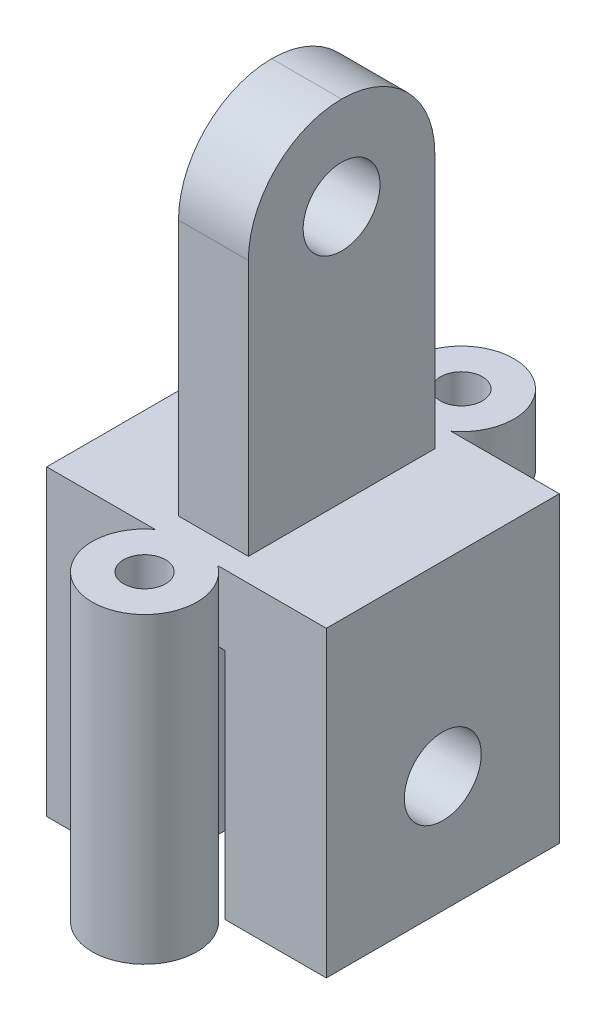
SolidWorks part; units mm, degrees
ref_plane "Front Plane" through (0, 0, 0) normal (0, 0, 1) x (1, 0, 0)
ref_plane "Top Plane" through (0, 0, 0) normal (0, 1, 0) x (1, 0, 0)
ref_plane "Right Plane" through (0, 0, 0) normal (1, 0, 0) x (0, 0, -1)
sketch "Sketch1" plane through (0, 0, 0) normal (0, 0, 1) x (1, 0, 0)
  line L0 (7.65, 0) -> (12, 0)
  line L1 (0, 0) -> (4.35, 0)
  line L2 (0, 0) -> (0, 13)
  line L3 (4.6556, 28) -> (7.6556, 28)
  line L4 (12, 0) -> (12, 13)
  line L6 (4.35, 0) -> (4.35, 10)
  line L7 (4.35, 10) -> (7.65, 10)
  line L8 (7.65, 0) -> (7.65, 10)
  line L11 (0, 13) -> (4.6556, 13)
  line L12 (4.6556, 28) -> (4.6556, 13)
  line L15 (12, 13) -> (7.6556, 13)
  line L16 (7.6556, 28) -> (7.6556, 13)
  dimension "D2" = 12
  dimension "D3" = 15
  dimension "D4" = 15
  dimension "D5" = 10
  dimension "D6" = 4.3444
  dimension "D7" = 3
  dimension "D8" = 4.35
  dimension "D9" = 3.3
extrude "Boss-Extrude1" add sketch "Sketch1" along normal blind 10
sketch "Sketch2" plane through (0, 0, 10) normal (0, 0, 1) x (1, 0, 0)
  line L0 (7.6556, 13) -> (7.6556, 28) construction
  line L1 (4.6556, 28) -> (7.6556, 28)
  line L2 (4.6556, 28) -> (4.6556, 13)
  line L3 (4.6556, 13) -> (7.6556, 13)
  line L4 (7.6556, 28) -> (7.6556, 13)
  line L5 (12, 13) -> (7.6556, 13) construction
extrude "Cut-Extrude1" cut sketch "Sketch2" against normal blind 1
sketch "Sketch3" plane through (0, 0, 0) normal (0, 0, -1) x (-1, 0, 0)
  line L1 (-7.6556, 28) -> (-4.6556, 28)
  line L2 (-7.6556, 28) -> (-7.6556, 13)
  line L3 (-7.6556, 13) -> (-4.6556, 13)
  line L4 (-4.6556, 28) -> (-4.6556, 13)
extrude "Cut-Extrude2" cut sketch "Sketch3" against normal blind 1
sketch "Sketch4" plane through (4.6556, 0, 0) normal (-1, 0, 0) x (0, 0, 1)
  line L0 (9, 28) -> (9, 13) construction
  line L1 (9, 28) -> (1, 28) construction
  circle A0 centre (5, 24) radius 1.65
  dimension "D1" = 3.3
  dimension "D2" = 4
  dimension "D3" = 4
extrude "Cut-Extrude3" cut sketch "Sketch4" against normal through all
fillet "Fillet1" radius 4 2 edges at (6.1556, 28, 1) (6.1556, 28, 9)
sketch "Sketch5" plane through (0, 0, 0) normal (-1, 0, 0) x (0, 0, 1)
  line L0 (10, 13) -> (10, 0) construction
  line L1 (10, 0) -> (0, 0) construction
  circle A0 centre (5, 5) radius 1.65
  dimension "D1" = 3.3
  dimension "D2" = 5
  dimension "D3" = 5
extrude "Cut-Extrude4" cut sketch "Sketch5" against normal through all
sketch "Sketch6" plane through (0, 10, 0) normal (0, -1, 0) x (1, 0, 0)
  line L0 (4.35, 10) -> (4.35, 0) construction
  line L1 (7.65, 0) -> (4.35, 0)
  line L2 (7.65, 0) -> (7.65, 0.5)
  line L3 (7.65, 0.5) -> (4.35, 0.5)
  line L4 (4.35, 0) -> (4.35, 0.5)
  dimension "D1" = 0.5
sketch "Sketch7" plane through (0, 13, 0) normal (0, 1, 0) x (1, 0, 0)
  line L0 (12, -10) -> (12, 0) construction
  line L1 (12, 0) -> (0, 0) construction
  line L2 (4.65, 0) -> (7.35, 0)
  arc A0 (7.35, 0) -> (4.65, 0) centre (6, 1.8) ccw
  dimension "D1" = 4.5
  dimension "D2" = 6
  dimension "D3" = 1.8
extrude "Boss-Extrude2" add sketch "Sketch7" against normal blind 3
sketch "Sketch8" plane through (0, 13, 0) normal (0, 1, 0) x (1, 0, 0)
  line L0 (12, -10) -> (0, -10) construction
  line L1 (4.65, -10) -> (7.35, -10)
  line L2 (12, -10) -> (12, 0) construction
  arc A0 (4.65, -10) -> (7.35, -10) centre (6, -11.8) ccw
  dimension "D1" = 4.5
  dimension "D2" = 1.8
  dimension "D3" = 6
extrude "Boss-Extrude3" add sketch "Sketch8" against normal blind 13
sketch "Sketch9" plane through (0, 13, 0) normal (0, 1, 0) x (1, 0, 0)
  circle A0 centre (6, -11.8) radius 0.9
  circle A1 centre (6, 1.8) radius 0.9
  arc A2 (7.35, 0) -> (4.65, 0) centre (6, 1.8) ccw construction
  arc A3 (4.65, -10) -> (7.35, -10) centre (6, -11.8) ccw construction
  dimension "D1" = 1.8
  dimension "D2" = 0
  dimension "D3" = 1.8
  dimension "D4" = 0
extrude "Cut-Extrude5" cut sketch "Sketch9" against normal through all both and the other way through all
